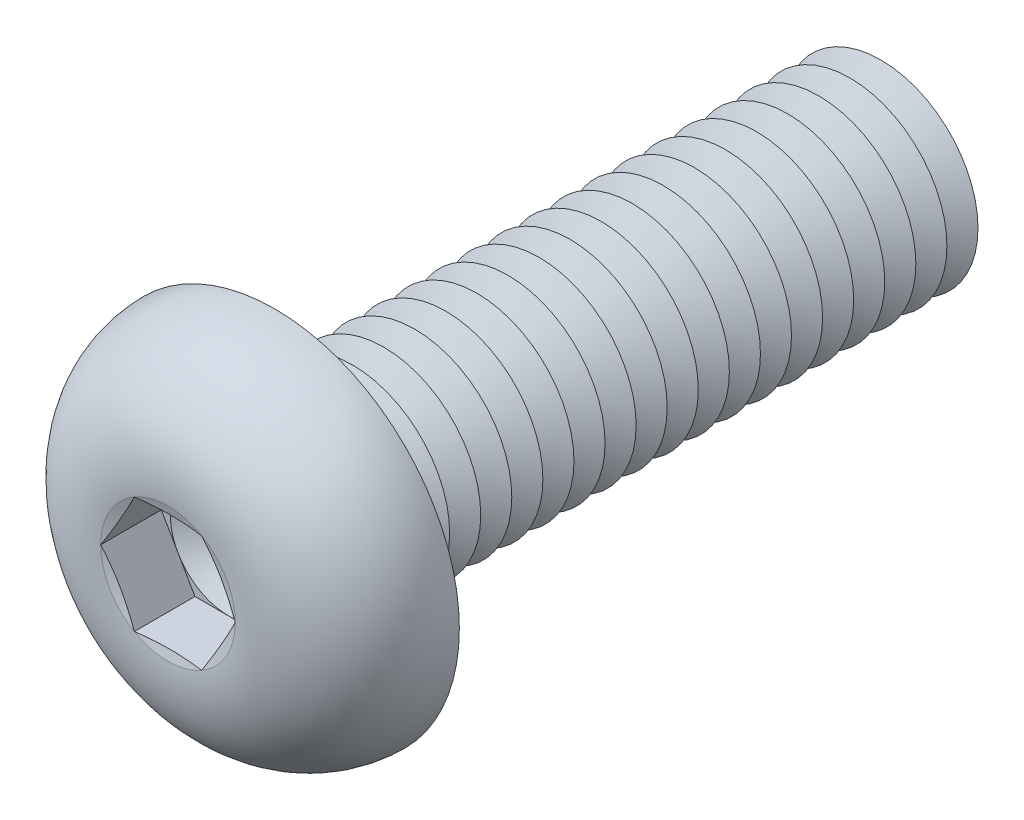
SolidWorks part; units mm, degrees
ref_plane "Front Plane" through (0, 0, 0) normal (0, 0, 1) x (1, 0, 0)
ref_plane "Top Plane" through (0, 0, 0) normal (0, 1, 0) x (1, 0, 0)
ref_plane "Right Plane" through (0, 0, 0) normal (1, 0, 0) x (0, 0, -1)
sketch "Sketch1" plane through (0, 0, 0) normal (1, 0, 0) x (0, 0, -1)
  line L0 (0, 2.5) -> (0, 4.75)
  line L3 (0, 2.5) -> (16, 2.5)
  line L4 (16, 2.5) -> (16, 0)
  line L5 (16, 0) -> (-2.75, 0) construction
  line L6 (-2.75, 0) -> (16, 0)
  line L7 (-2.75, 1.732) -> (-2.75, 0.866) construction
  line L8 (-2.75, 0.866) -> (-2.75, 0)
  line L9 (-2.75, 1.732) -> (-2.5179, 0.866)
  line L10 (-2.5179, 0.866) -> (-2.75, 0.866)
  line L11 (16, 0) -> (22.7481, 0) construction
  line L12 (0, 4.75) -> (-2.75, 4.75) construction
  arc A1 (0, 4.75) -> (-2.75, 1.732) centre (0, 1.9881) ccw
  point P8 (16, 1.25)
  dimension "D1" = 9.5
  dimension "D2" = 5
  dimension "D3" = 2.75
  dimension "D4" = 3.4641
  dimension "D5" = 16
  dimension "D6" = 15
revolve "Revolve1" add sketch "Sketch1" angle 360 about L5
fillet "Fillet1" radius 0.4 1 edges at (-2.5, 0, 0)
sketch "Sketch2" plane through (0, 0, 0) normal (1, 0, 0) x (0, 0, -1)
  line L0 (15.6, 2.5) -> (16.4, 2.5)
  line L1 (16, 2.5) -> (0.4, 2.5) construction
  line L2 (16.4, 2.5) -> (16, 1.8072)
  line L3 (16, -2.5) -> (16, 2.5) construction
  line L4 (16, 1.8072) -> (15.6, 2.5)
  dimension "D1" = 0.8
revolve "Cut-Revolve1" cut sketch "Sketch2" angle 360 about axis through (0, 0, -16) along (0, 0, -1)
pattern_linear "LPattern1" count 20 spacing 0.8 along (0, 0, 1) of "Cut-Revolve1"
sketch "Sketch3" plane through (0, 0, 2.75) normal (0, 0, 1) x (1, 0, 0)
  line L7 (0.866, 1.5) -> (-0.866, 1.5)
  line L8 (-0.866, 1.5) -> (-1.7321, 0)
  line L9 (-1.7321, 0) -> (-0.866, -1.5)
  line L10 (-0.866, -1.5) -> (0.866, -1.5)
  line L11 (0.866, -1.5) -> (1.7321, 0)
  line L12 (1.7321, 0) -> (0.866, 1.5)
  circle A0 centre (0, 0) radius 1.5 construction
  circle A3 centre (0, 0) radius 1.732 construction
extrude "Cut-Extrude1" cut sketch "Sketch3" against normal blind 1.56
sketch "Sketch4" plane through (0, 0, 1.19) normal (0, 0, 1) x (1, 0, 0)
  line L1 (0.866, 1.5) -> (-0.866, 1.5) construction
  circle A0 centre (0, 0) radius 1.5
extrude "Cut-Extrude2" cut sketch "Sketch4" against normal through all draft 60
